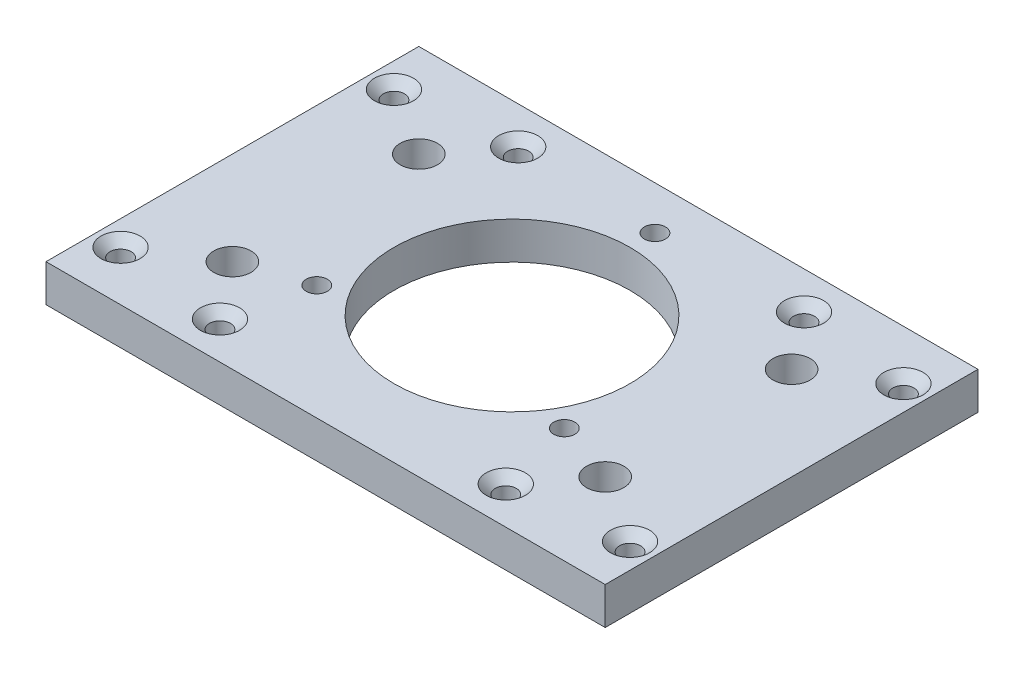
SolidWorks part; units mm, degrees
ref_plane "Front Plane" through (0, 0, 0) normal (0, 0, 1) x (1, 0, 0)
ref_plane "Top Plane" through (0, 0, 0) normal (0, 1, 0) x (1, 0, 0)
ref_plane "Right Plane" through (0, 0, 0) normal (1, 0, 0) x (0, 0, -1)
sketch "Sketch1" plane through (0, 0, 0) normal (1, 0, 0) x (0, 0, -1)
  line L1 (-30, -3) -> (30, -3)
  line L2 (-30, -3) -> (-30, 3)
  line L3 (-30, 3) -> (30, 3)
  line L4 (30, -3) -> (30, 3)
  line L5 (-30, -3) -> (30, 3) construction
  line L6 (-30, 3) -> (30, -3) construction
  point P0 (0, 0)
  dimension "D1" = 6
  dimension "D2" = 60
extrude "Boss-Extrude1" add sketch "Sketch1" along normal mid plane 90
sketch "Sketch2" plane through (0, 3, 0) normal (0, 1, 0) x (1, 0, 0)
  circle A0 centre (0, 0) radius 19
  dimension "D1" = 38
extrude "Cut-Extrude1" cut sketch "Sketch2" against normal through all
hole_wizard "CSK for M3 Flat Head Machine Screw1" positions "Sketch4" profile "Sketch3" countersink size "M3" standard "ANSI Metric"
sketch "Sketch4" plane through (0, 3, 0) normal (0, 1, 0) x (1, 0, 0)
  point P0 (-23, 24)
  point P3 (23, 24)
  point P6 (23, -24)
  point P9 (-23, -24)
sketch "Sketch3" plane through (-23, 3, -24) normal (1, 0, 0) x (0, 0, 1)
  line L0 (0, 0) -> (0, 6)
  line L1 (0, 6) -> (1.7, 6)
  line L2 (1.7, 6) -> (1.7, 1.45)
  line L3 (1.7, 1.45) -> (3.15, 0)
  line L5 (3.15, 0) -> (0, 0)
  line L6 (-1.7, 1.45) -> (-3.15, 0) construction
  line L11 (0, -6.35) -> (0, 107.95) construction
  dimension "Thru Hole Dia." = 3.4
  dimension "Thru Hole Depth" = 6
  dimension "Near C'Sink Dia." = 6.3
  dimension "Near C'Sink Angle" = 90
hole_wizard "CSK for M3 Flat Head Machine Screw2" positions "Sketch6" profile "Sketch5" countersink size "M3" standard "ANSI Metric"
sketch "Sketch6" plane through (0, 3, 0) normal (0, 1, 0) x (1, 0, 0)
  point P0 (-41, 22)
  point P3 (41, 22)
  point P6 (41, -22)
  point P9 (-41, -22)
sketch "Sketch5" plane through (-41, 3, -22) normal (1, 0, 0) x (0, 0, 1)
  line L0 (0, 0) -> (0, 6)
  line L1 (0, 6) -> (1.7, 6)
  line L2 (1.7, 6) -> (1.7, 1.45)
  line L3 (1.7, 1.45) -> (3.15, 0)
  line L5 (3.15, 0) -> (0, 0)
  line L6 (-1.7, 1.45) -> (-3.15, 0) construction
  line L11 (0, -6.35) -> (0, 107.95) construction
  dimension "Thru Hole Dia." = 3.4
  dimension "Thru Hole Depth" = 6
  dimension "Near C'Sink Dia." = 6.3
  dimension "Near C'Sink Angle" = 90
hole_wizard "CSK for M3 Flat Head Machine Screw3" positions "Sketch8" profile "Sketch7" countersink size "M3" standard "ANSI Metric"
sketch "Sketch8" plane through (0, -3, 0) normal (0, -1, 0) x (-1, 0, 0)
  point P0 (19.9186, -11.5)
  point P3 (-19.9186, -11.5)
  point P6 (0, 23)
sketch "Sketch7" plane through (-19.9186, -3, 11.5) normal (1, 0, 0) x (0, 0, -1)
  line L0 (0, 0) -> (0, 6)
  line L1 (0, 6) -> (1.7, 6)
  line L2 (1.7, 6) -> (1.7, 1.45)
  line L3 (1.7, 1.45) -> (3.15, 0)
  line L5 (3.15, 0) -> (0, 0)
  line L6 (-1.7, 1.45) -> (-3.15, 0) construction
  line L11 (0, -6.35) -> (0, 107.95) construction
  dimension "Thru Hole Dia." = 3.4
  dimension "Thru Hole Depth" = 6
  dimension "Near C'Sink Dia." = 6.3
  dimension "Near C'Sink Angle" = 90
hole_wizard "Ø6.0 (6) Diameter Hole1" positions "Sketch10" profile "Sketch9" hole size "Ø6.0" standard "ANSI Metric"
sketch "Sketch10" plane through (0, 3, 0) normal (0, 1, 0) x (1, 0, 0)
  point P0 (-30, 15)
  point P3 (-30, -15)
  point P6 (30, -15)
  point P9 (30, 15)
sketch "Sketch9" plane through (-30, 3, -15) normal (1, 0, 0) x (0, 0, 1)
  line L0 (0, 0) -> (0, 6)
  line L1 (0, 6) -> (3, 6)
  line L2 (3, 6) -> (3, 0)
  line L5 (3, 0) -> (0, 0)
  line L11 (0, -6.35) -> (0, 107.95) construction
  dimension "Thru Hole Dia." = 6
  dimension "Thru Hole Depth" = 6
